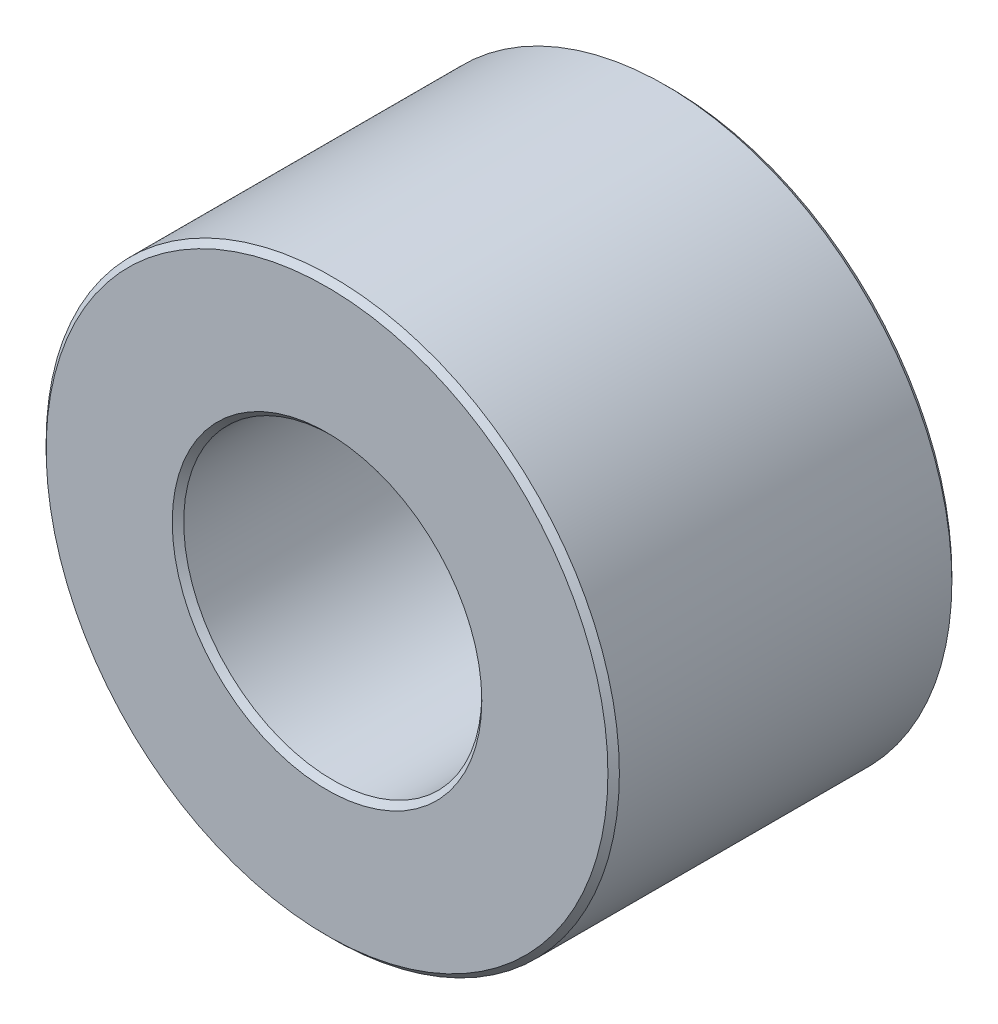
SolidWorks part; units mm, degrees
ref_plane "Front Plane" through (0, 0, 0) normal (0, 0, 1) x (1, 0, 0)
ref_plane "Top Plane" through (0, 0, 0) normal (0, 1, 0) x (1, 0, 0)
ref_plane "Right Plane" through (0, 0, 0) normal (1, 0, 0) x (0, 0, -1)
sketch "Sketch1" plane through (0, 0, 0) normal (0, 0, 1) x (1, 0, 0)
  circle A0 centre (0, 0) radius 5
  circle A1 centre (0, 0) radius 2.6
  dimension "D1" = 10
  dimension "D2" = 5.2
extrude "Boss-Extrude2" add sketch "Sketch1" along normal mid plane 6
chamfer "Chamfer3" distance 0.1 angle 45 4 edges at (5, 0, 3) (5, 0, -3) (2.6, 0, -3) (2.6, 0, 3)
